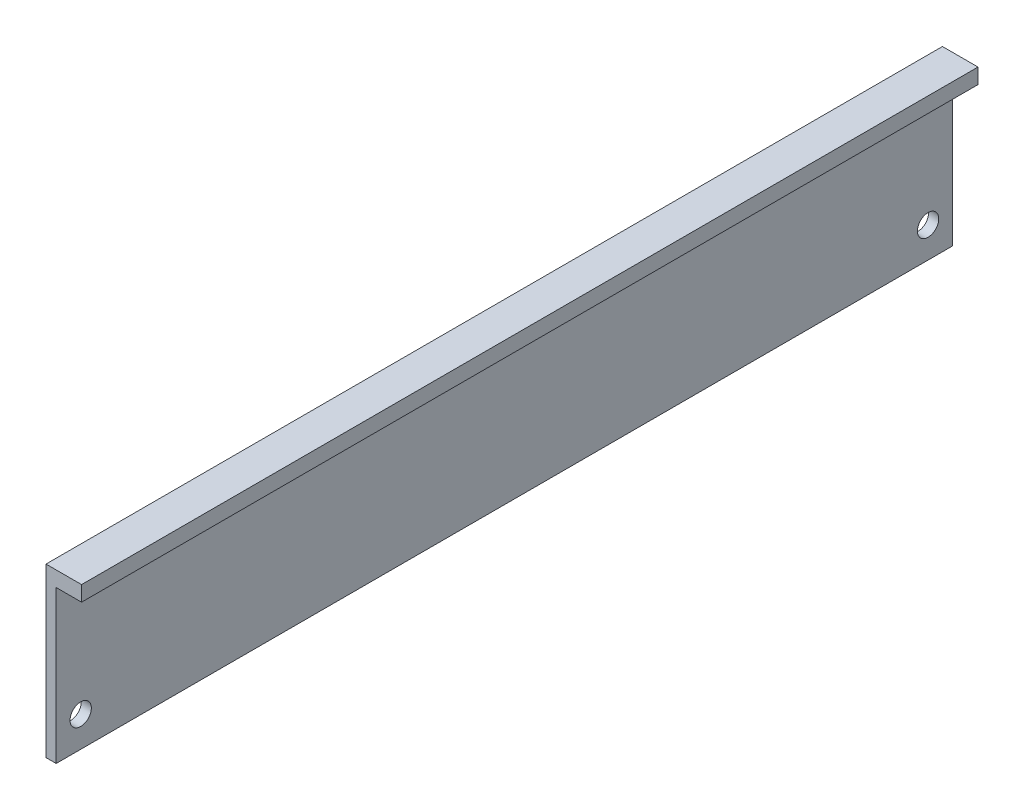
SolidWorks part; units mm, degrees
ref_plane "前视基准面" through (0, 0, 0) normal (0, 0, 1) x (1, 0, 0)
ref_plane "上视基准面" through (0, 0, 0) normal (0, 1, 0) x (1, 0, 0)
ref_plane "右视基准面" through (0, 0, 0) normal (1, 0, 0) x (0, 0, -1)
ref_plane "基准面1" through (4153.3665, 0, 0) normal (1, 0, 0) x (0, 0, -1)
sketch "草图1" plane through (4153.3665, 0, 0) normal (1, 0, 0) x (0, 0, -1)
  line L0 (132, 1662.2659) -> (132, 1695.2659)
  line L1 (132, 1695.2659) -> (0, 1695.2659)
  line L2 (0, 1695.2659) -> (0, 1662.2659)
  line L3 (0, 1662.2659) -> (132, 1662.2659)
extrude "凸台-拉伸1" add sketch "草图1" against normal blind 7
sketch "草图2" plane through (0, 0, -132) normal (0, 0, -1) x (-1, 0, 0)
  line L0 (-4148.3665, 1692.2659) -> (-4153.3665, 1692.2659)
  line L1 (-4153.3665, 1692.2659) -> (-4153.3665, 1662.2659)
  line L2 (-4153.3665, 1662.2659) -> (-4148.3665, 1662.2659)
  line L3 (-4148.3665, 1662.2659) -> (-4148.3665, 1692.2659)
extrude "切除-拉伸1" cut sketch "草图2" against normal through all
hole_wizard "Ø4.2 (4.2) 直径孔1" positions "草图4" profile "草图3" hole size "Ø4.2" standard "ANSI Metric"
sketch "草图4" plane through (4146.3665, 0, 0) normal (-1, 0, 0) x (0, 0, 1)
  point P0 (-127.175, 1668.2659)
sketch "草图3" plane through (4146.3665, 1668.2659, -127.175) normal (0, 1, 0) x (0, 0, 1)
  line L0 (0, 0) -> (0, 7)
  line L1 (0, 7) -> (2.1, 7)
  line L2 (2.1, 7) -> (2.1, 0)
  line L5 (2.1, 0) -> (0, 0)
  line L11 (0, -6.35) -> (0, 107.95) construction
  dimension "通孔孔直径" = 4.2
  dimension "通孔孔深度" = 7
sketch "草图5" plane through (0, 0, 0) normal (0, 0, 1) x (1, 0, 0)
  line L6 (4148.3665, 1662.2659) -> (4148.3665, 1692.2659)
  line L7 (4148.3665, 1692.2659) -> (4153.3665, 1692.2659)
  line L8 (4153.3665, 1692.2659) -> (4153.3665, 1695.2659)
  line L9 (4153.3665, 1695.2659) -> (4146.3665, 1695.2659)
  line L10 (4146.3665, 1695.2659) -> (4146.3665, 1662.2659)
  line L11 (4146.3665, 1662.2659) -> (4148.3665, 1662.2659)
  line L12 (4148.3665, 1662.2659) -> (4148.3665, 1692.2659)
  line L13 (4148.3665, 1692.2659) -> (4153.3665, 1692.2659)
  line L14 (4153.3665, 1692.2659) -> (4153.3665, 1695.2659)
  line L15 (4153.3665, 1695.2659) -> (4146.3665, 1695.2659)
  line L16 (4146.3665, 1695.2659) -> (4146.3665, 1662.2659)
  line L17 (4146.3665, 1662.2659) -> (4148.3665, 1662.2659)
  dimension "D1" = 0
extrude "凸台-拉伸2" add sketch "草图5" along normal blind 44.45
sketch "草图6" plane through (4146.3665, 0, 0) normal (-1, 0, 0) x (0, 0, 1)
  line L0 (-43.775, 1662.2659) -> (-43.775, 1689.8942) construction
  line L1 (44.45, 1662.2659) -> (-132, 1662.2659) construction
  line L2 (44.45, 1695.2659) -> (44.45, 1662.2659) construction
  circle A0 centre (39.62, 1668.2659) radius 2.1
  circle A1 centre (-127.175, 1668.2659) radius 2.1
  dimension "D1" = 4.83
  dimension "D2" = 6
extrude "切除-拉伸2" cut sketch "草图6" against normal through all
